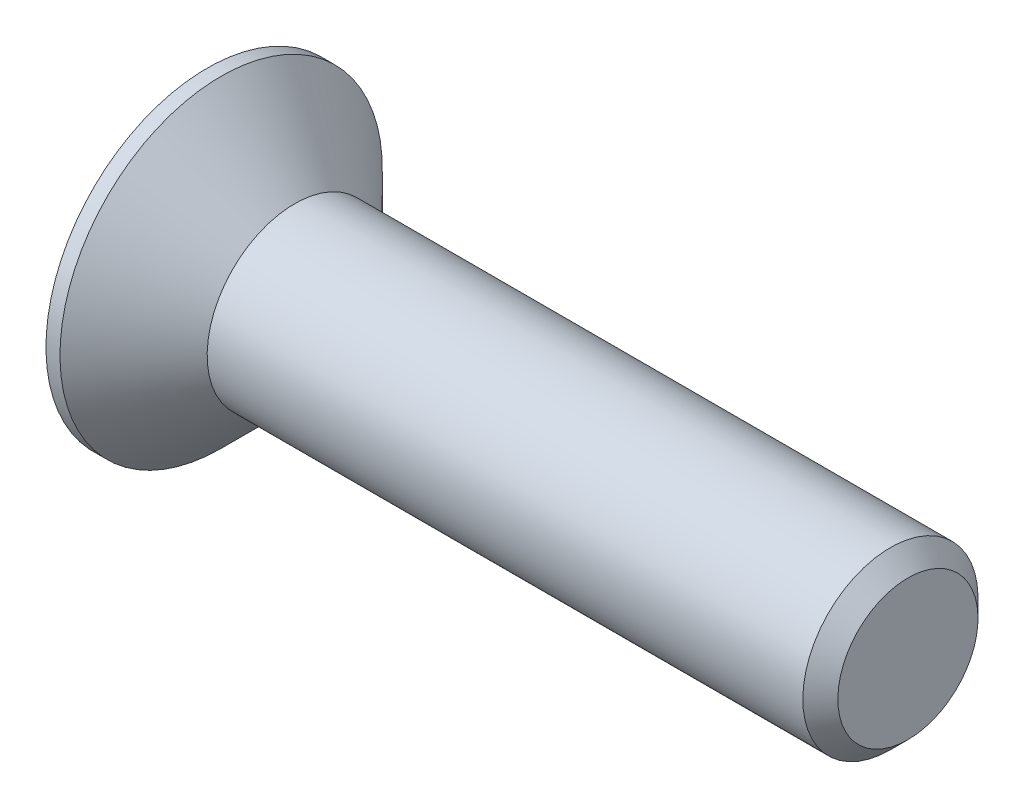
SolidWorks part; units mm, degrees
ref_plane "Front Plane" through (0, 0, 0) normal (0, 0, 1) x (1, 0, 0)
ref_plane "Top Plane" through (0, 0, 0) normal (0, 1, 0) x (1, 0, 0)
ref_plane "Right Plane" through (0, 0, 0) normal (1, 0, 0) x (0, 0, -1)
sketch "Sketch1" plane through (0, 0, 0) normal (0, 0, 1) x (1, 0, 0)
  line L1 (-2.5, 4.6) -> (-2.5, 0)
  line L2 (-2.5, 0) -> (17.5, 0)
  line L3 (17.5, 0) -> (17.5, 2.5)
  line L4 (17.5, 2.5) -> (0, 2.5)
  line L5 (-2.5, 4.6) -> (-2.1, 4.6)
  line L6 (-2.1, 4.6) -> (0, 2.5)
  dimension "D1" = 2.5
  dimension "D2" = 45
  dimension "D3" = 2.5
  dimension "D4" = 20
  dimension "D5" = 4.6
revolve "Revolve1" add sketch "Sketch1" angle 360 about L2
chamfer "Chamfer1" distance 0.5 angle 45 1 edges at (17.5, -2.5, 0)
sketch "Sketch2" plane through (-2.5, 0, 0) normal (-1, 0, 0) x (0, 0, 1)
  line L0 (-0.575, 2.3) -> (0.575, 2.3)
  line L1 (0.575, 2.3) -> (0.575, 0.575)
  line L2 (0.575, 0.575) -> (2.3, 0.575)
  line L3 (2.3, 0.575) -> (2.3, -0.575)
  line L4 (2.3, -0.575) -> (0.575, -0.575)
  line L5 (0.575, -0.575) -> (0.575, -2.3)
  line L6 (0.575, -2.3) -> (-0.575, -2.3)
  line L7 (-0.575, -2.3) -> (-0.575, -0.575)
  line L8 (-0.575, -0.575) -> (-2.3, -0.575)
  line L9 (-2.3, -0.575) -> (-2.3, 0.575)
  line L10 (-2.3, 0.575) -> (-0.575, 0.575)
  line L11 (-0.575, 0.575) -> (-0.575, 2.3)
  point P2 (0, 2.3)
  point P14 (0, -2.3)
  point P15 (2.3, 0)
  point P16 (-2.3, 0)
  dimension "D1" = 4.6
  dimension "D2" = 1.15
extrude "Cut-Extrude1" cut sketch "Sketch2" against normal blind 2.1
